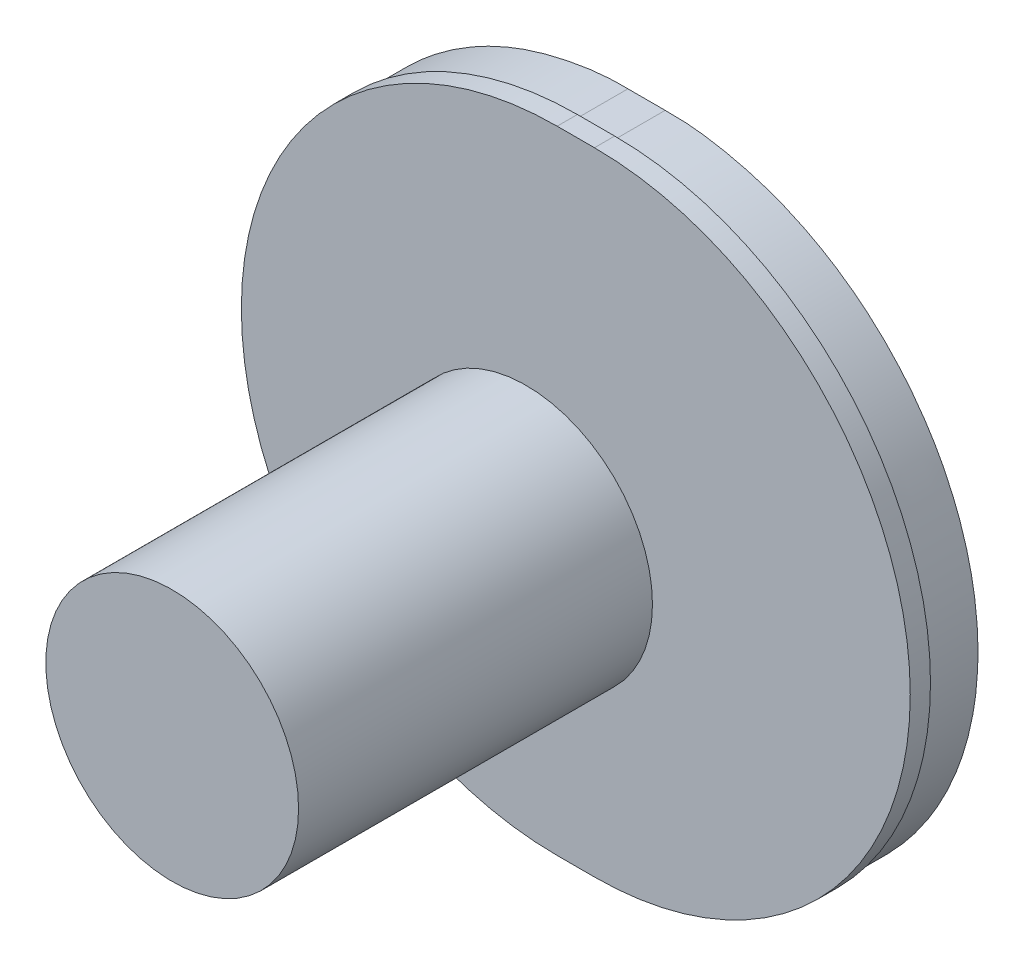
SolidWorks part; units mm, degrees
ref_plane "Front Plane" through (0, 0, 0) normal (0, 0, 1) x (1, 0, 0)
ref_plane "Top Plane" through (0, 0, 0) normal (0, 1, 0) x (1, 0, 0)
ref_plane "Right Plane" through (0, 0, 0) normal (1, 0, 0) x (0, 0, -1)
sketch "Sketch1" plane through (0, 0, 0) normal (0, 1, 0) x (1, 0, 0)
  line L0 (0, 46.8486) -> (0, -70.4594) construction
ref_plane "Plane1" through (0, 0, 70.4594) normal (0, 0, 1) x (1, 0, 0)
sketch "Sketch2" plane through (0, 0, 70.4594) normal (0, 0, 1) x (1, 0, 0)
  circle A0 centre (0, 0) radius 12.5
  point P0 (0, 0)
extrude "Boss-Extrude1" add sketch "Sketch2" against normal blind 35
sketch "Sketch3" plane through (0, 0, 35.4594) normal (0, 0, -1) x (-1, 0, 0)
  circle A0 centre (0, 0) radius 5
extrude "Boss-Extrude2" add sketch "Sketch3" along normal blind 5
sketch "Sketch4" plane through (0, 0, 30.4594) normal (0, 0, -1) x (-1, 0, 0)
  line L0 (-1.7641, 0) -> (1.9264, 0) construction
  line L1 (-1.7641, 31.2328) -> (1.9264, 31.2328)
  line L2 (-1.7641, -31.2328) -> (1.9264, -31.2328)
  arc A0 (-1.7641, 31.2328) -> (-1.7641, -31.2328) centre (-1.7641, 0) ccw
  arc A1 (1.9264, -31.2328) -> (1.9264, 31.2328) centre (1.9264, 0) ccw
  point P3 (0.0812, 0)
extrude "Boss-Extrude3" add sketch "Sketch4" along normal blind 2
sketch3d "3DSketch1"
  line L0 (-1.9264, 27.2328, 28.4594) -> (1.7641, 27.2328, 28.4594)
  line L1 (1.7641, -27.2328, 28.4594) -> (-1.9264, -27.2328, 28.4594)
  line L2 (-1.9264, 27.2328, 28.4594) -> (1.7641, 27.2328, 28.4594)
  line L3 (1.7641, -27.2328, 28.4594) -> (-1.9264, -27.2328, 28.4594)
  line L4 (-1.9264, 30.9328, 28.4594) -> (1.7591, 30.9328, 28.4594)
  line L5 (1.764, -30.9328, 28.4594) -> (-1.9264, -30.9328, 28.4594)
  line L6 (-1.9264, 30.9328, 28.4594) -> (1.7591, 30.9328, 28.4594)
  line L7 (1.764, -30.9328, 28.4594) -> (-1.9264, -30.9328, 28.4594)
  spline S0 degree 5 poles (34.4921, -1026.548, 28.4594) (34.4837, -409.5385, 28.4594) (28.697, -109.997, 28.4594) (19.114, -19.0263, 28.4594) (7.0732, -28.2206, 28.4594) (-4.7802, -27.1201, 28.4594) (-5.4122, -27.0368, 28.4594) (-6.9861, -26.78, 28.4594) (-8.5384, -26.4326, 28.4594) (-9.4599, -26.1886, 28.4594) (-11.2787, -25.6233, 28.4594) (-13.0407, -24.8918, 28.4594) (-13.9053, -24.4865, 28.4594) (-15.5969, -23.6008, 28.4594) (-17.2045, -22.5728, 28.4594) (-17.9854, -22.0243, 28.4594) (-19.4972, -20.8609, 28.4594) (-20.9014, -19.569, 28.4594) (-21.5748, -18.8927, 28.4594) (-22.8609, -17.4829, 28.4594) (-24.0187, -15.9661, 28.4594) (-24.564, -15.183, 28.4594) (-25.5851, -13.5711, 28.4594) (-26.4611, -11.8759, 28.4594) (-26.8618, -11.0097, 28.4594) (-27.5866, -9.2446, 28.4594) (-28.154, -7.4228, 28.4594) (-28.3978, -6.5001, 28.4594) (-28.8042, -4.6358, 28.4594) (-29.0458, -2.743, 28.4594) (-29.1252, -1.792, 28.4594) (-29.2008, 0.1147, 28.4594) (-29.1092, 2.0206, 28.4594) (-29.0218, 2.9709, 28.4594) (-28.7643, 4.8616, 28.4594) (-28.3422, 6.7224, 28.4594) (-28.0907, 7.6431, 28.4594) (-27.5079, 9.46, 28.4594) (-26.7683, 11.219, 28.4594) (-26.3604, 12.0818, 28.4594) (-25.4702, 13.7695, 28.4594) (-24.4356, 15.3728, 28.4594) (-23.8836, 16.1513, 28.4594) (-22.7132, 17.6583, 28.4594) (-21.4153, 19.0572, 28.4594) (-20.7362, 19.7278, 28.4594) (-19.3212, 21.0079, 28.4594) (-17.7997, 22.1586, 28.4594) (-17.0142, 22.7004, 28.4594) (-15.398, 23.7149, 28.4594) (-13.699, 24.5864, 28.4594) (-12.8311, 24.9844, 28.4594) (-11.0771, 25.6954, 28.4594) (-9.2685, 26.242, 28.4594) (-8.36, 26.4757, 28.4594) (-6.8355, 26.8065, 28.4594) (-5.291, 27.0499, 28.4594) (-4.6739, 27.1283, 28.4594) (6.9859, 28.1681, 28.4594) (18.8223, 19.2839, 28.4594) (28.2578, 110.5619, 28.4594) (33.9889, 410.1212, 28.4594) (34.0841, 1026.5521, 28.4594) knots -0.639088 -0.639088 -0.639088 -0.639088 -0.639088 -0.639088 0.018568 0.018568 0.018568 0.055704 0.055704 0.055704 0.111408 0.111408 0.111408 0.167112 0.167112 0.167112 0.222816 0.222816 0.222816 0.278519 0.278519 0.278519 0.334223 0.334223 0.334223 0.389927 0.389927 0.389927 0.445631 0.445631 0.445631 0.501335 0.501335 0.501335 0.557039 0.557039 0.557039 0.612743 0.612743 0.612743 0.668447 0.668447 0.668447 0.72415 0.72415 0.72415 0.779854 0.779854 0.779854 0.835558 0.835558 0.835558 0.891262 0.891262 0.891262 0.946076 0.946076 0.946076 0.982322 0.982322 0.982322 1.629454 1.629454 1.629454 1.629454 1.629454 1.629454 only from (-1.9264, -27.2328, 28.4594) to (-1.9264, 27.2328, 28.4594)
  spline S1 degree 5 poles (-34.6544, 1026.548, 28.4594) (-34.646, 409.5385, 28.4594) (-28.8593, 109.997, 28.4594) (-19.2763, 19.0263, 28.4594) (-7.2356, 28.2206, 28.4594) (4.6178, 27.1201, 28.4594) (5.2499, 27.0368, 28.4594) (6.8238, 26.78, 28.4594) (8.3761, 26.4326, 28.4594) (9.2976, 26.1886, 28.4594) (11.1164, 25.6233, 28.4594) (12.8784, 24.8918, 28.4594) (13.7429, 24.4865, 28.4594) (15.4345, 23.6008, 28.4594) (17.0422, 22.5728, 28.4594) (17.823, 22.0243, 28.4594) (19.3349, 20.8609, 28.4594) (20.739, 19.569, 28.4594) (21.4124, 18.8927, 28.4594) (22.6986, 17.4829, 28.4594) (23.8563, 15.9661, 28.4594) (24.4017, 15.183, 28.4594) (25.4227, 13.5711, 28.4594) (26.2987, 11.8759, 28.4594) (26.6994, 11.0097, 28.4594) (27.4242, 9.2446, 28.4594) (27.9917, 7.4228, 28.4594) (28.2355, 6.5001, 28.4594) (28.6419, 4.6358, 28.4594) (28.8835, 2.743, 28.4594) (28.9629, 1.792, 28.4594) (29.0385, -0.1147, 28.4594) (28.9468, -2.0206, 28.4594) (28.8594, -2.9709, 28.4594) (28.6019, -4.8616, 28.4594) (28.1799, -6.7224, 28.4594) (27.9283, -7.6431, 28.4594) (27.3456, -9.46, 28.4594) (26.606, -11.219, 28.4594) (26.198, -12.0818, 28.4594) (25.3078, -13.7695, 28.4594) (24.2732, -15.3728, 28.4594) (23.7213, -16.1513, 28.4594) (22.5508, -17.6583, 28.4594) (21.2529, -19.0572, 28.4594) (20.5738, -19.7278, 28.4594) (19.1589, -21.0079, 28.4594) (17.6373, -22.1586, 28.4594) (16.8519, -22.7004, 28.4594) (15.2356, -23.7149, 28.4594) (13.5367, -24.5864, 28.4594) (12.6688, -24.9844, 28.4594) (10.9148, -25.6954, 28.4594) (9.1061, -26.242, 28.4594) (8.1977, -26.4757, 28.4594) (6.6731, -26.8065, 28.4594) (5.1286, -27.0499, 28.4594) (4.5116, -27.1283, 28.4594) (-7.1483, -28.1681, 28.4594) (-18.9847, -19.2839, 28.4594) (-28.4202, -110.5619, 28.4594) (-34.1512, -410.1212, 28.4594) (-34.2464, -1026.5521, 28.4594) knots -0.639088 -0.639088 -0.639088 -0.639088 -0.639088 -0.639088 0.018568 0.018568 0.018568 0.055704 0.055704 0.055704 0.111408 0.111408 0.111408 0.167112 0.167112 0.167112 0.222816 0.222816 0.222816 0.278519 0.278519 0.278519 0.334223 0.334223 0.334223 0.389927 0.389927 0.389927 0.445631 0.445631 0.445631 0.501335 0.501335 0.501335 0.557039 0.557039 0.557039 0.612743 0.612743 0.612743 0.668447 0.668447 0.668447 0.72415 0.72415 0.72415 0.779854 0.779854 0.779854 0.835558 0.835558 0.835558 0.891262 0.891262 0.891262 0.946076 0.946076 0.946076 0.982322 0.982322 0.982322 1.629454 1.629454 1.629454 1.629454 1.629454 1.629454 only from (1.7641, 27.2328, 28.4594) to (1.7641, -27.2328, 28.4594)
  spline S2 degree 5 poles (-1.9264, -27.2328, 28.4594) (-2.2438, -27.2328, 28.4594) (-2.5611, -27.2328, 28.4594) (-2.8783, -27.2304, 28.4594) (-3.8299, -27.2083, 28.4594) (-4.7802, -27.1201, 28.4594) (-5.4122, -27.0368, 28.4594) (-6.9861, -26.78, 28.4594) (-8.5384, -26.4326, 28.4594) (-9.4599, -26.1886, 28.4594) (-11.2787, -25.6233, 28.4594) (-13.0407, -24.8918, 28.4594) (-13.9053, -24.4865, 28.4594) (-15.5969, -23.6008, 28.4594) (-17.2045, -22.5728, 28.4594) (-17.9854, -22.0243, 28.4594) (-19.4972, -20.8609, 28.4594) (-20.9014, -19.569, 28.4594) (-21.5748, -18.8927, 28.4594) (-22.8609, -17.4829, 28.4594) (-24.0187, -15.9661, 28.4594) (-24.564, -15.183, 28.4594) (-25.5851, -13.5711, 28.4594) (-26.4611, -11.8759, 28.4594) (-26.8618, -11.0097, 28.4594) (-27.5866, -9.2446, 28.4594) (-28.154, -7.4228, 28.4594) (-28.3978, -6.5001, 28.4594) (-28.8042, -4.6358, 28.4594) (-29.0458, -2.743, 28.4594) (-29.1252, -1.792, 28.4594) (-29.2008, 0.1147, 28.4594) (-29.1092, 2.0206, 28.4594) (-29.0218, 2.9709, 28.4594) (-28.7643, 4.8616, 28.4594) (-28.3422, 6.7224, 28.4594) (-28.0907, 7.6431, 28.4594) (-27.5079, 9.46, 28.4594) (-26.7683, 11.219, 28.4594) (-26.3604, 12.0818, 28.4594) (-25.4702, 13.7695, 28.4594) (-24.4356, 15.3728, 28.4594) (-23.8836, 16.1513, 28.4594) (-22.7132, 17.6583, 28.4594) (-21.4153, 19.0572, 28.4594) (-20.7362, 19.7278, 28.4594) (-19.3212, 21.0079, 28.4594) (-17.7997, 22.1586, 28.4594) (-17.0142, 22.7004, 28.4594) (-15.398, 23.7149, 28.4594) (-13.699, 24.5864, 28.4594) (-12.8311, 24.9844, 28.4594) (-11.0771, 25.6954, 28.4594) (-9.2685, 26.242, 28.4594) (-8.36, 26.4757, 28.4594) (-6.8355, 26.8065, 28.4594) (-5.291, 27.0499, 28.4594) (-4.6739, 27.1283, 28.4594) (-3.7539, 27.2103, 28.4594) (-2.8327, 27.2306, 28.4594) (-2.5307, 27.2328, 28.4594) (-2.2285, 27.2328, 28.4594) (-1.9264, 27.2328, 28.4594) knots 0 0 0 0 0 0 0.018568 0.018568 0.018568 0.055704 0.055704 0.055704 0.111408 0.111408 0.111408 0.167112 0.167112 0.167112 0.222816 0.222816 0.222816 0.278519 0.278519 0.278519 0.334223 0.334223 0.334223 0.389927 0.389927 0.389927 0.445631 0.445631 0.445631 0.501335 0.501335 0.501335 0.557039 0.557039 0.557039 0.612743 0.612743 0.612743 0.668447 0.668447 0.668447 0.72415 0.72415 0.72415 0.779854 0.779854 0.779854 0.835558 0.835558 0.835558 0.891262 0.891262 0.891262 0.946076 0.946076 0.946076 0.982322 0.982322 0.982322 1 1 1 1 1 1
  spline S3 degree 5 poles (1.7641, 27.2328, 28.4594) (2.0814, 27.2328, 28.4594) (2.3987, 27.2328, 28.4594) (2.716, 27.2304, 28.4594) (3.6675, 27.2083, 28.4594) (4.6178, 27.1201, 28.4594) (5.2499, 27.0368, 28.4594) (6.8238, 26.78, 28.4594) (8.3761, 26.4326, 28.4594) (9.2976, 26.1886, 28.4594) (11.1164, 25.6233, 28.4594) (12.8784, 24.8918, 28.4594) (13.7429, 24.4865, 28.4594) (15.4345, 23.6008, 28.4594) (17.0422, 22.5728, 28.4594) (17.823, 22.0243, 28.4594) (19.3349, 20.8609, 28.4594) (20.739, 19.569, 28.4594) (21.4124, 18.8927, 28.4594) (22.6986, 17.4829, 28.4594) (23.8563, 15.9661, 28.4594) (24.4017, 15.183, 28.4594) (25.4227, 13.5711, 28.4594) (26.2987, 11.8759, 28.4594) (26.6994, 11.0097, 28.4594) (27.4242, 9.2446, 28.4594) (27.9917, 7.4228, 28.4594) (28.2355, 6.5001, 28.4594) (28.6419, 4.6358, 28.4594) (28.8835, 2.743, 28.4594) (28.9629, 1.792, 28.4594) (29.0385, -0.1147, 28.4594) (28.9468, -2.0206, 28.4594) (28.8594, -2.9709, 28.4594) (28.6019, -4.8616, 28.4594) (28.1799, -6.7224, 28.4594) (27.9283, -7.6431, 28.4594) (27.3456, -9.46, 28.4594) (26.606, -11.219, 28.4594) (26.198, -12.0818, 28.4594) (25.3078, -13.7695, 28.4594) (24.2732, -15.3728, 28.4594) (23.7213, -16.1513, 28.4594) (22.5508, -17.6583, 28.4594) (21.2529, -19.0572, 28.4594) (20.5738, -19.7278, 28.4594) (19.1589, -21.0079, 28.4594) (17.6373, -22.1586, 28.4594) (16.8519, -22.7004, 28.4594) (15.2356, -23.7149, 28.4594) (13.5367, -24.5864, 28.4594) (12.6688, -24.9844, 28.4594) (10.9148, -25.6954, 28.4594) (9.1061, -26.242, 28.4594) (8.1977, -26.4757, 28.4594) (6.6731, -26.8065, 28.4594) (5.1286, -27.0499, 28.4594) (4.5116, -27.1283, 28.4594) (3.5915, -27.2103, 28.4594) (2.6704, -27.2306, 28.4594) (2.3683, -27.2328, 28.4594) (2.0662, -27.2328, 28.4594) (1.7641, -27.2328, 28.4594) knots 0 0 0 0 0 0 0.018568 0.018568 0.018568 0.055704 0.055704 0.055704 0.111408 0.111408 0.111408 0.167112 0.167112 0.167112 0.222816 0.222816 0.222816 0.278519 0.278519 0.278519 0.334223 0.334223 0.334223 0.389927 0.389927 0.389927 0.445631 0.445631 0.445631 0.501335 0.501335 0.501335 0.557039 0.557039 0.557039 0.612743 0.612743 0.612743 0.668447 0.668447 0.668447 0.72415 0.72415 0.72415 0.779854 0.779854 0.779854 0.835558 0.835558 0.835558 0.891262 0.891262 0.891262 0.946076 0.946076 0.946076 0.982322 0.982322 0.982322 1 1 1 1 1 1
  spline S4 degree 5 poles (39.3322, -1030.0679, 28.4594) (38.3251, -412.413, 28.4594) (31.5265, -112.948, 28.4594) (20.9254, -22.3941, 28.4594) (7.7803, -32.0069, 28.4594) (-5.1679, -30.8048, 28.4594) (-5.8858, -30.7102, 28.4594) (-7.6736, -30.4185, 28.4594) (-9.4368, -30.0239, 28.4594) (-10.4834, -29.7467, 28.4594) (-12.5494, -29.1047, 28.4594) (-14.5508, -28.2738, 28.4594) (-15.5328, -27.8134, 28.4594) (-17.4542, -26.8073, 28.4594) (-19.2803, -25.6396, 28.4594) (-20.1673, -25.0167, 28.4594) (-21.8845, -23.6952, 28.4594) (-23.4794, -22.2277, 28.4594) (-24.2443, -21.4595, 28.4594) (-25.7052, -19.8582, 28.4594) (-27.0202, -18.1354, 28.4594) (-27.6397, -17.2458, 28.4594) (-28.7995, -15.4149, 28.4594) (-29.7945, -13.4894, 28.4594) (-30.2496, -12.5056, 28.4594) (-31.0729, -10.5006, 28.4594) (-31.7175, -8.4313, 28.4594) (-31.9944, -7.3833, 28.4594) (-32.456, -5.2656, 28.4594) (-32.7304, -3.1157, 28.4594) (-32.8206, -2.0354, 28.4594) (-32.9065, 0.1302, 28.4594) (-32.8024, 2.2951, 28.4594) (-32.7031, 3.3746, 28.4594) (-32.4106, 5.5221, 28.4594) (-31.9312, 7.6358, 28.4594) (-31.6455, 8.6815, 28.4594) (-30.9836, 10.7453, 28.4594) (-30.1435, 12.7433, 28.4594) (-29.6801, 13.7233, 28.4594) (-28.6689, 15.6403, 28.4594) (-27.4938, 17.4614, 28.4594) (-26.8669, 18.3457, 28.4594) (-25.5374, 20.0574, 28.4594) (-24.0631, 21.6464, 28.4594) (-23.2918, 22.4081, 28.4594) (-21.6846, 23.8622, 28.4594) (-19.9563, 25.1692, 28.4594) (-19.0641, 25.7846, 28.4594) (-17.2283, 26.9369, 28.4594) (-15.2985, 27.9268, 28.4594) (-14.3127, 28.379, 28.4594) (-12.3204, 29.1865, 28.4594) (-10.266, 29.8074, 28.4594) (-9.2341, 30.0728, 28.4594) (-7.5024, 30.4485, 28.4594) (-5.7481, 30.7251, 28.4594) (-5.0472, 30.8141, 28.4594) (7.6889, 31.9499, 28.4594) (20.6105, 22.6612, 28.4594) (31.047, 113.5366, 28.4594) (37.7732, 413.0215, 28.4594) (38.8512, 1030.074, 28.4594) knots -0.612481 -0.612481 -0.612481 -0.612481 -0.612481 -0.612481 0.018568 0.018568 0.018568 0.055704 0.055704 0.055704 0.111408 0.111408 0.111408 0.167112 0.167112 0.167112 0.222816 0.222816 0.222816 0.278519 0.278519 0.278519 0.334223 0.334223 0.334223 0.389927 0.389927 0.389927 0.445631 0.445631 0.445631 0.501335 0.501335 0.501335 0.557039 0.557039 0.557039 0.612743 0.612743 0.612743 0.668447 0.668447 0.668447 0.72415 0.72415 0.72415 0.779854 0.779854 0.779854 0.835558 0.835558 0.835558 0.891262 0.891262 0.891262 0.946076 0.946076 0.946076 0.982322 0.982322 0.982322 1.603248 1.603248 1.603248 1.603248 1.603248 1.603248 only from (-1.9264, -30.9328, 28.4594) to (-1.9264, 30.9328, 28.4594)
  spline S5 degree 5 number of poles 66 (1.7591, 30.9328, 28.4594) -> (1.764, -30.9328, 28.4594)
  spline S6 degree 5 poles (-1.9264, -30.9328, 28.4594) (-2.2869, -30.9328, 28.4594) (-2.6473, -30.9328, 28.4594) (-3.0077, -30.93, 28.4594) (-4.0885, -30.905, 28.4594) (-5.1679, -30.8048, 28.4594) (-5.8858, -30.7102, 28.4594) (-7.6736, -30.4185, 28.4594) (-9.4368, -30.0239, 28.4594) (-10.4834, -29.7467, 28.4594) (-12.5494, -29.1047, 28.4594) (-14.5508, -28.2738, 28.4594) (-15.5328, -27.8134, 28.4594) (-17.4542, -26.8073, 28.4594) (-19.2803, -25.6396, 28.4594) (-20.1673, -25.0167, 28.4594) (-21.8845, -23.6952, 28.4594) (-23.4794, -22.2277, 28.4594) (-24.2443, -21.4595, 28.4594) (-25.7052, -19.8582, 28.4594) (-27.0202, -18.1354, 28.4594) (-27.6397, -17.2458, 28.4594) (-28.7995, -15.4149, 28.4594) (-29.7945, -13.4894, 28.4594) (-30.2496, -12.5056, 28.4594) (-31.0729, -10.5006, 28.4594) (-31.7175, -8.4313, 28.4594) (-31.9944, -7.3833, 28.4594) (-32.456, -5.2656, 28.4594) (-32.7304, -3.1157, 28.4594) (-32.8206, -2.0354, 28.4594) (-32.9065, 0.1302, 28.4594) (-32.8024, 2.2951, 28.4594) (-32.7031, 3.3746, 28.4594) (-32.4106, 5.5221, 28.4594) (-31.9312, 7.6358, 28.4594) (-31.6455, 8.6815, 28.4594) (-30.9836, 10.7453, 28.4594) (-30.1435, 12.7433, 28.4594) (-29.6801, 13.7233, 28.4594) (-28.6689, 15.6403, 28.4594) (-27.4938, 17.4614, 28.4594) (-26.8669, 18.3457, 28.4594) (-25.5374, 20.0574, 28.4594) (-24.0631, 21.6464, 28.4594) (-23.2918, 22.4081, 28.4594) (-21.6846, 23.8622, 28.4594) (-19.9563, 25.1692, 28.4594) (-19.0641, 25.7846, 28.4594) (-17.2283, 26.9369, 28.4594) (-15.2985, 27.9268, 28.4594) (-14.3127, 28.379, 28.4594) (-12.3204, 29.1865, 28.4594) (-10.266, 29.8074, 28.4594) (-9.2341, 30.0728, 28.4594) (-7.5024, 30.4485, 28.4594) (-5.7481, 30.7251, 28.4594) (-5.0472, 30.8141, 28.4594) (-4.0022, 30.9073, 28.4594) (-2.9558, 30.9303, 28.4594) (-2.6127, 30.9328, 28.4594) (-2.2696, 30.9328, 28.4594) (-1.9264, 30.9328, 28.4594) knots 0 0 0 0 0 0 0.018568 0.018568 0.018568 0.055704 0.055704 0.055704 0.111408 0.111408 0.111408 0.167112 0.167112 0.167112 0.222816 0.222816 0.222816 0.278519 0.278519 0.278519 0.334223 0.334223 0.334223 0.389927 0.389927 0.389927 0.445631 0.445631 0.445631 0.501335 0.501335 0.501335 0.557039 0.557039 0.557039 0.612743 0.612743 0.612743 0.668447 0.668447 0.668447 0.72415 0.72415 0.72415 0.779854 0.779854 0.779854 0.835558 0.835558 0.835558 0.891262 0.891262 0.891262 0.946076 0.946076 0.946076 0.982322 0.982322 0.982322 1 1 1 1 1 1
  spline S7 degree 5 number of poles 66 (1.7591, 30.9328, 28.4594) -> (1.764, -30.9328, 28.4594)
  dimension "D1" = 4
  dimension "D2" = 0.3
extrude "Boss-Extrude4" add sketch "3DSketch1" along direction (0, 0, -1) on the side of the normal blind 5
sketch "Sketch5" plane through (0, 0, 28.4594) normal (0, 0, -1) x (-1, 0, 0)
  circle A0 centre (0, 0) radius 3
extrude "Boss-Extrude5" add sketch "Sketch5" along normal blind 2
